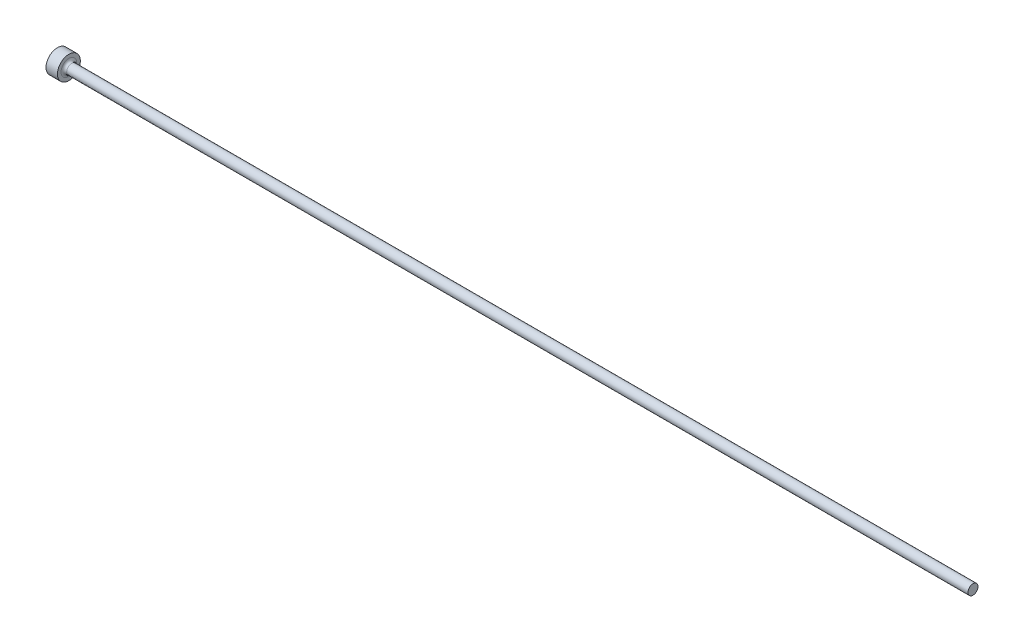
SolidWorks part; units mm, degrees
ref_plane "Front Plane" through (0, 0, 0) normal (0, 0, 1) x (1, 0, 0)
ref_plane "Top Plane" through (0, 0, 0) normal (0, 1, 0) x (1, 0, 0)
ref_plane "Right Plane" through (0, 0, 0) normal (1, 0, 0) x (0, 0, -1)
sketch "Sketch1" plane through (0, 0, 0) normal (0, 0, 1) x (1, 0, 0)
  line L0 (0, 0) -> (0, 3.175)
  line L1 (0, 3.175) -> (3.175, 3.175)
  line L2 (3.175, 3.175) -> (3.175, 2.1755)
  line L3 (3.9624, 1.3881) -> (254, 1.3881)
  line L4 (254, 1.3881) -> (254, 0)
  line L5 (254, 0) -> (0, 0)
  line L6 (254, 0) -> (0, 0) construction
  line L7 (0, 0) -> (-10.4771, 0) construction
  line L8 (254, 0) -> (1002.3976, 0) construction
  arc A0 (3.9624, 1.3881) -> (3.175, 2.1755) centre (3.9624, 2.1755) cw
  dimension "D1" = 0.7874
  dimension "HeadDia" = 6.35
  dimension "HeadThickness" = 3.175
  dimension "PinDia" = 2.7762
  dimension "overall" = 254
revolve "PIN" add sketch "Sketch1" angle 360 about L6
